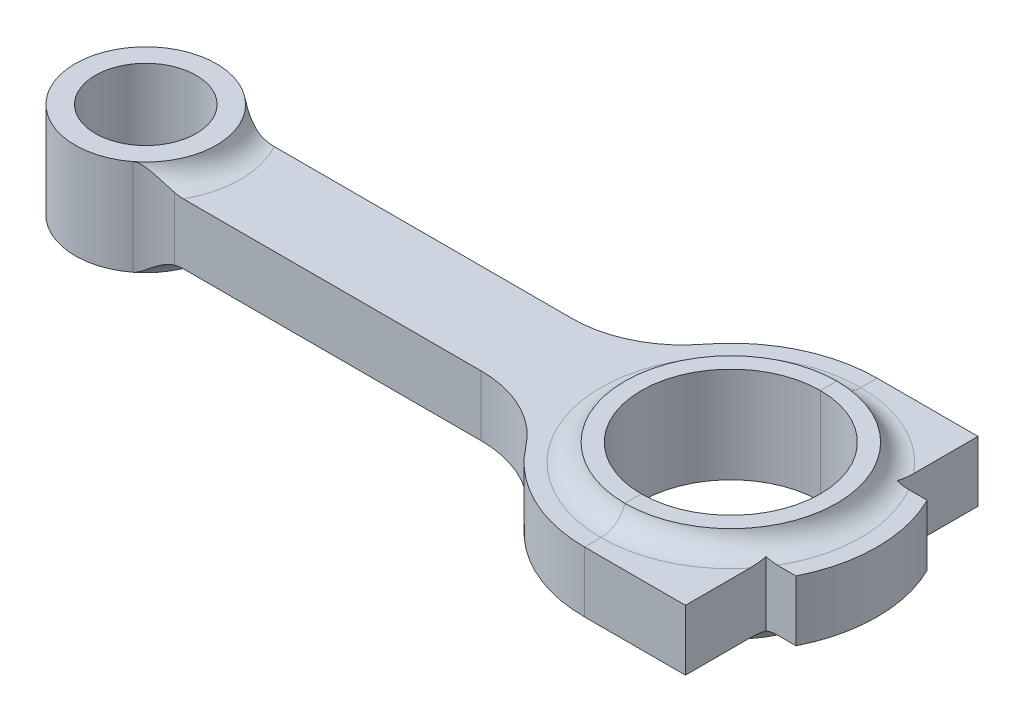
SolidWorks part; units mm, degrees
ref_plane "Front Plane" through (0, 0, 0) normal (0, 0, 1) x (1, 0, 0)
ref_plane "Top Plane" through (0, 0, 0) normal (0, 1, 0) x (1, 0, 0)
ref_plane "Right Plane" through (0, 0, 0) normal (1, 0, 0) x (0, 0, -1)
sketch "Sketch1" plane through (0, 0, 0) normal (0, 1, 0) x (1, 0, 0)
  line L0 (0, 0) -> (-116, 0) construction
  line L1 (-105.2762, 9) -> (-27.5681, 9)
  line L2 (-105.2762, -9) -> (-27.5681, -9)
  line L6 (0, 0) -> (38.305, 0) construction
  circle A0 centre (-116, 0) radius 10
  circle A1 centre (0, 0) radius 17.75
  circle A2 centre (-116, 0) radius 14
  circle A3 centre (0, 0) radius 29
  dimension "D2" = 35.5
  dimension "D3" = 20
  dimension "D4" = 58
  dimension "D5" = 28
  dimension "D1" = 116
  dimension "D6" = 18
extrude "Boss-Extrude1" add sketch "Sketch1" along normal mid plane 12 contours A3 L1 A2 L2 | A2 A0 | A3 A1
fillet "Fillet1" radius 22 2 edges at (-27.5681, 0, -9) (-27.5681, 0, 9)
fillet "Fillet2" radius 10 2 edges at (-105.2762, 0, -9) (-105.2762, 0, 9)
sketch "Sketch2" plane through (0, 0, 0) normal (0, 1, 0) x (1, 0, 0)
  circle A0 centre (-116, 0) radius 10 construction
  circle A1 centre (-116, 0) radius 10
  circle A2 centre (0, 0) radius 17.75 construction
  circle A3 centre (0, 0) radius 17.75
  circle A4 centre (0, 0) radius 21
  circle A5 centre (-116, 0) radius 14
  dimension "D1" = 42
extrude "Boss-Extrude2" add sketch "Sketch2" along normal mid plane 19
fillet "Fillet3" radius 5 4 edges at (0, -6, 21) (0, 6, 21) (-102, 6, 0) (-102, -6, 0)
sketch "Sketch3" plane through (0, 0, 0) normal (0, 1, 0) x (1, 0, 0)
  line L0 (0, 29) -> (0, -29) construction
  line L1 (0, 29) -> (20, 29)
  line L2 (20, 29) -> (20, 13)
  line L3 (20, 13) -> (35.004, 13)
  line L4 (35.004, 13) -> (35.004, -13)
  line L5 (35.004, -13) -> (20, -13)
  line L6 (20, -13) -> (20, -29)
  line L7 (20, -29) -> (0, -29)
  line L8 (0, 0) -> (35.004, 0) construction
  arc A0 (-23.0277, -17.6275) -> (-23.0277, 17.6275) centre (0, 0) ccw construction
  point P8 (0, 0)
  dimension "D1" = 20
  dimension "D2" = 26
  dimension "D3" = 16
extrude "Cut-Extrude1" cut sketch "Sketch3" against normal through all both and the other way through all
sketch "Sketch6" plane through (20, 0, 0) normal (1, 0, 0) x (0, 0, -1)
  line L0 (13, 6) -> (13, -6) construction
  line L1 (29, 6) -> (13, 6)
  line L2 (29, 6) -> (29, -6)
  line L3 (29, -6) -> (13, -6)
  line L4 (13, 6) -> (13, -6)
  line L5 (17.6275, -6) -> (29, -6) construction
  line L6 (-13, -6) -> (-13, 6) construction
  line L7 (-29, 6) -> (-13, 6)
  line L8 (-29, 6) -> (-29, -6)
  line L9 (-29, -6) -> (-13, -6)
  line L10 (-13, 6) -> (-13, -6)
  line L11 (-21, -6) -> (-16.2505, -6) construction
extrude "Boss-Extrude3" add sketch "Sketch6" against normal up to next contours L2 L3 L4 L1
sketch "Sketch4" plane through (0, 0, 0) normal (0, 1, 0) x (1, 0, 0)
  line L0 (0, 51.7071) -> (0, -51.7071)
  point P4 (0, 0)
split "Split1" trim tools "Sketch4" bodies to split 106 resulting bodies 104 105
